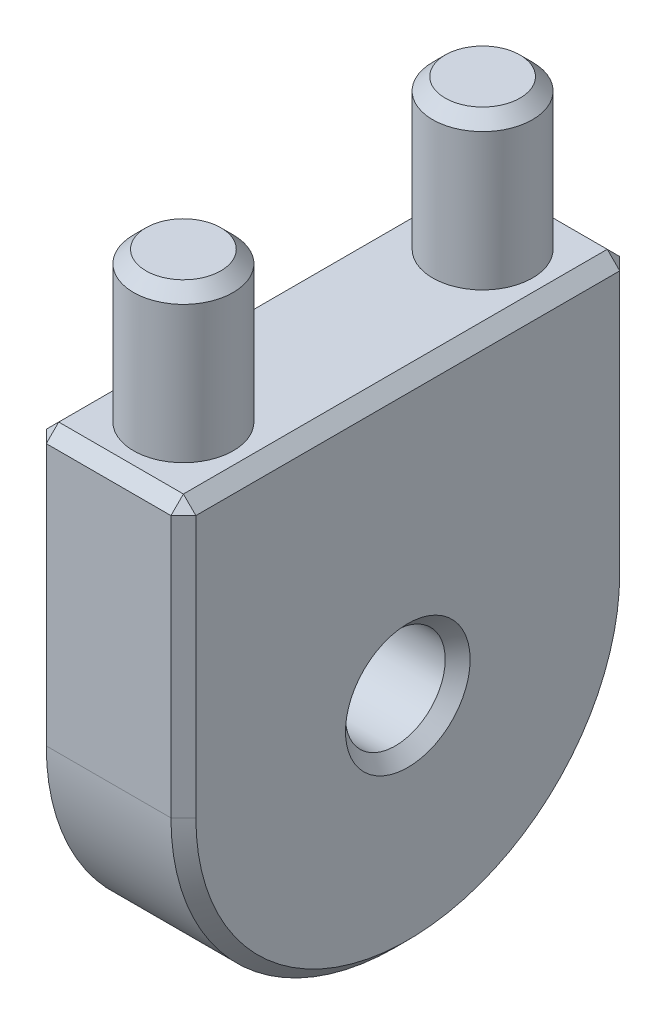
SolidWorks part; units mm, degrees
ref_plane "Спереди" through (0, 0, 0) normal (0, 0, 1) x (1, 0, 0)
ref_plane "Сверху" through (0, 0, 0) normal (0, 1, 0) x (1, 0, 0)
ref_plane "Справа" through (0, 0, 0) normal (1, 0, 0) x (0, 0, -1)
sketch "Эскиз1" plane through (0, 0, 0) normal (1, 0, 0) x (0, 0, -1)
  line L0 (-9, 0) -> (-9, 11)
  line L1 (-9, 11) -> (9, 11)
  line L2 (9, 11) -> (9, 0)
  circle A0 centre (0, 0) radius 2
  arc A1 (-9, 0) -> (9, 0) centre (0, 0) ccw
  dimension "D1" = 4
  dimension "D2" = 18
  dimension "D3" = 11
extrude "Бобышка-Вытянуть1" add sketch "Эскиз1" along normal mid plane 6
sketch "Эскиз3" plane through (0, 11, 0) normal (0, 1, 0) x (1, 0, 0)
  line L0 (0, 6) -> (0, 0) construction
  line L1 (0, 0) -> (0, -6) construction
  circle A0 centre (0, 6) radius 2
  circle A1 centre (0, -6) radius 2
  dimension "D1" = 4
  dimension "D2" = 12
extrude "Бобышка-Вытянуть2" add sketch "Эскиз3" along normal blind 6
chamfer "Фаска1" distance 0.5 angle 45 14 edges at (0, 17, -4) (-3, 0, -2) (3, 0, -2) (-3, 5.5, -9) (-3, 11, 0) (-3, -9, 0) (-3, 5.5, 9) (3, 5.5, 9) (3, -9, 0) (3, 5.5, -9) (0, 11, -9) (3, 11, 0) (0, 11, 9) (0, 17, 8)
